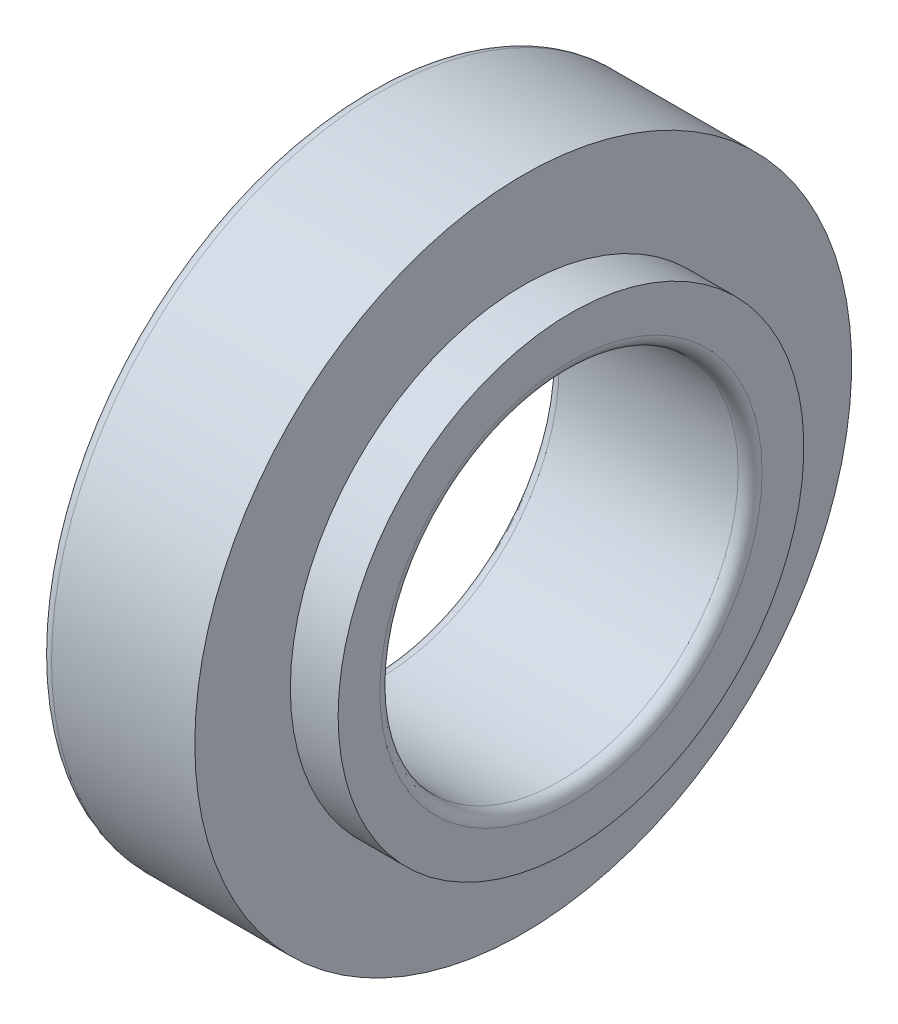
SolidWorks part; units mm, degrees
ref_plane "Front" through (0, 0, 0) normal (0, 0, 1) x (1, 0, 0)
ref_plane "Top" through (0, 0, 0) normal (0, 1, 0) x (1, 0, 0)
ref_plane "Right" through (0, 0, 0) normal (1, 0, 0) x (0, 0, -1)
sketch "Sketch1" plane through (0, 0, 0) normal (0, 0, 1) x (1, 0, 0)
  line L0 (0, 0) -> (17, 0) construction
  line L1 (1, 27.5) -> (13, 27.5)
  line L2 (13, 27.5) -> (13, 19.5)
  line L3 (13, 19.5) -> (17, 19.5)
  line L4 (17, 19.5) -> (17, 16)
  line L5 (16, 15) -> (1, 15)
  line L6 (0, 24) -> (4, 24)
  line L7 (4, 24) -> (4, 17.5)
  line L8 (0, 16) -> (0, 17.5)
  line L9 (4, 17.5) -> (0, 17.5)
  line L10 (0, 24) -> (0, 26.5)
  arc A0 (17, 16) -> (16, 15) centre (16, 16) cw
  arc A1 (0, 16) -> (1, 15) centre (1, 16) ccw
  arc A2 (1, 27.5) -> (0, 26.5) centre (1, 26.5) ccw
  point P11 (17, 15)
  point P14 (0, 15)
  point P17 (0, 27.5)
  dimension "D6" = 1
  dimension "D1" = 55
  dimension "D2" = 30
  dimension "D3" = 17
  dimension "D4" = 13
  dimension "D5" = 17
  dimension "D7" = 48
  dimension "D8" = 39
  dimension "D9" = 35
revolve "Revolve1" add sketch "Sketch1" angle 360 about L0
